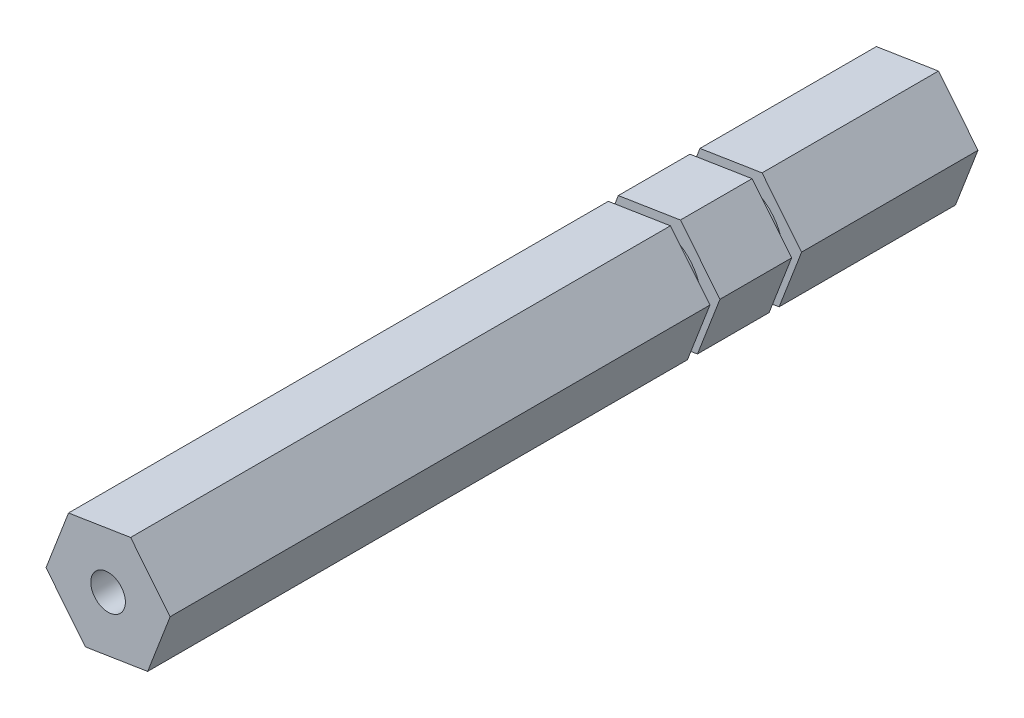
SolidWorks part; units mm, degrees
ref_plane "Front Plane" through (0, 0, 0) normal (0, 0, 1) x (1, 0, 0)
ref_plane "Top Plane" through (0, 0, 0) normal (0, 1, 0) x (1, 0, 0)
ref_plane "Right Plane" through (0, 0, 0) normal (1, 0, 0) x (0, 0, -1)
sketch "Sketch1" plane through (0, 0, 0) normal (0, 0, 1) x (1, 0, 0)
  line L1 (2.6268, 6.8457) -> (-4.6151, 5.6977)
  line L2 (-4.6151, 5.6977) -> (-7.2419, -1.148)
  line L3 (-7.2419, -1.148) -> (-2.6268, -6.8457)
  line L4 (-2.6268, -6.8457) -> (4.6151, -5.6977)
  line L5 (4.6151, -5.6977) -> (7.2419, 1.148)
  line L6 (7.2419, 1.148) -> (2.6268, 6.8457)
  circle A0 centre (0, 0) radius 6.35 construction
  point P10 (0, 0)
  dimension "D1" = 12.7
extrude "Boss-Extrude1" add sketch "Sketch1" along normal blind 94.234
ref_plane "Plane1" through (0, 0, 0) normal (0.7771, 0.6294, 0) x (0, 0, -1)
sketch "Sketch6" plane through (0, 0, 0) normal (0.7771, 0.6294, 0) x (0, 0, -1)
  line L0 (-94.234, 7.3323) -> (0, 7.3323) construction
  line L2 (-30.099, 7.3323) -> (-31.2674, 7.3323)
  line L3 (-30.099, 7.3323) -> (-30.099, 5.0292)
  line L4 (-30.099, 5.0292) -> (-31.2674, 5.0292)
  line L5 (0, 0) -> (-76.4075, 0) construction
  line L6 (0, 3.6662) -> (0, 7.3323) construction
  line L7 (-31.2674, 7.3323) -> (-31.2674, 5.0292)
  line L8 (-21.7424, 7.3323) -> (-20.574, 7.3323)
  line L9 (-21.7424, 7.3323) -> (-21.7424, 5.0292)
  line L10 (-21.7424, 5.0292) -> (-20.574, 5.0292)
  line L11 (-20.574, 7.3323) -> (-20.574, 5.0292)
  dimension "D1" = 1.1684
  dimension "D2" = 10.0584
  dimension "D3" = 9.525
  dimension "D4" = 20.574
revolve "Cut-Revolve1" cut sketch "Sketch6" angle 360 about L5
hole_wizard "Tap Drill for #10-32 Tap2" positions "3DSketch5" profile "Sketch9" hole size "#10-32" standard "ANSI Inch"
sketch3d "3DSketch5"
  line L0 (-4.6151, 5.6977, 94.234) -> (4.6151, -5.6977, 94.234) construction
  line L2 (-7.2419, -1.148, 94.234) -> (7.2419, 1.148, 94.234) construction
  line L3 (-4.6151, 5.6977, 0) -> (4.6151, -5.6977, 0) construction
  line L5 (-7.2419, -1.148, 0) -> (7.2419, 1.148, 0) construction
  point P0 (0, 0, 94.234)
  point P14 (0, 0, 0)
  point P28 (0, 0, 0)
  point P30 (0, 0, 0)
  point P34 (0, 0, 0)
  point P37 (0, 0, 0)
  point P39 (0, 0, 0)
  point P41 (0, 0, 0)
sketch "Sketch9" plane through (0, 0, 94.234) normal (1, 0, 0) x (0, -1, 0)
  line L0 (0, 0) -> (0, 13.9133)
  line L1 (0, 13.9133) -> (2.0193, 12.7)
  line L2 (2.0193, 12.7) -> (2.0193, 0)
  line L5 (2.0193, 0) -> (0, 0)
  line L10 (0, 13.9133) -> (-2.0193, 12.7) construction
  line L11 (0, -6.35) -> (0, 107.95) construction
  dimension "Hole Dia." = 4.0386
  dimension "Hole Depth" = 12.7
  dimension "Drill Angle" = 118
hole_wizard "Tap Drill for #10-32 Tap3" positions "3DSketch6" profile "Sketch8" hole size "#10-32" standard "ANSI Inch"
sketch3d "3DSketch6"
  line L0 (-7.2419, -1.148, 0) -> (7.2419, 1.148, 0) construction
  line L2 (-4.6151, 5.6977, 0) -> (4.6151, -5.6977, 0) construction
  point P0 (0, 0, 0)
sketch "Sketch8" plane through (0, 0, 0) normal (1, 0, 0) x (0, 1, 0)
  line L0 (0, 0) -> (0, 13.9133)
  line L1 (0, 13.9133) -> (2.0193, 12.7)
  line L2 (2.0193, 12.7) -> (2.0193, 0)
  line L5 (2.0193, 0) -> (0, 0)
  line L10 (0, 13.9133) -> (-2.0193, 12.7) construction
  line L11 (0, -6.35) -> (0, 107.95) construction
  dimension "Hole Dia." = 4.0386
  dimension "Hole Depth" = 12.7
  dimension "Drill Angle" = 118
